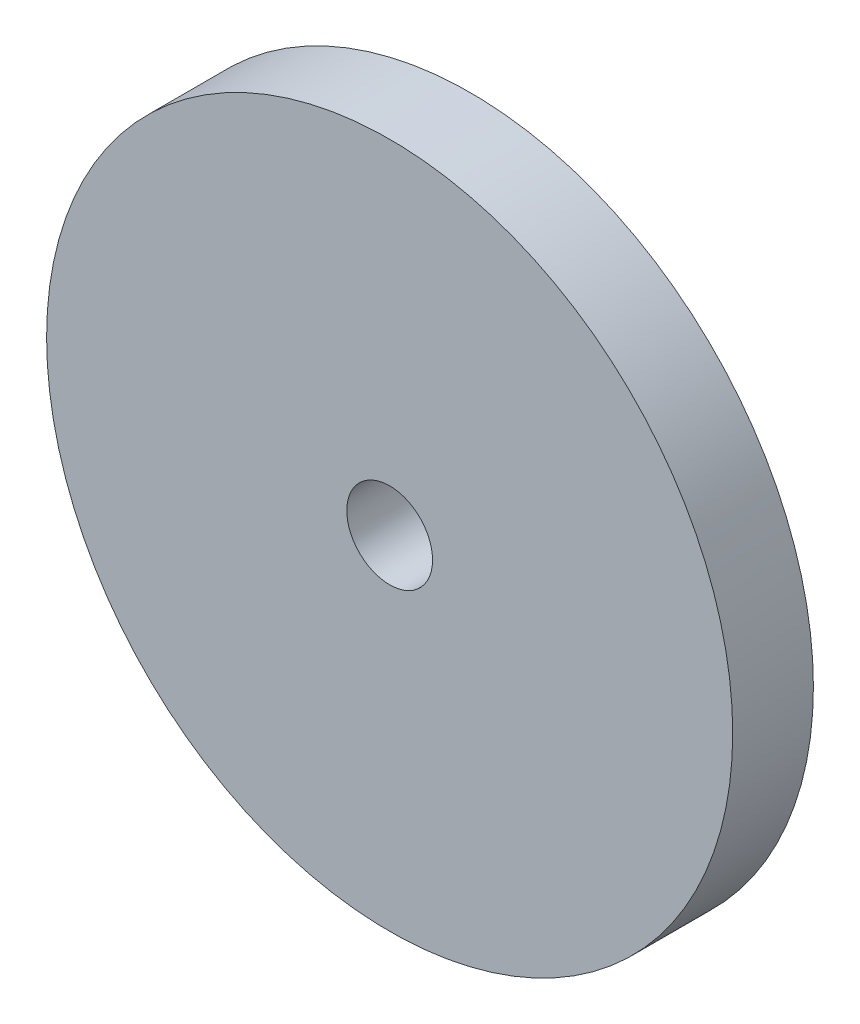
SolidWorks part; units mm, degrees
ref_plane "Front Plane" through (0, 0, 0) normal (0, 0, 1) x (1, 0, 0)
ref_plane "Top Plane" through (0, 0, 0) normal (0, 1, 0) x (1, 0, 0)
ref_plane "Right Plane" through (0, 0, 0) normal (1, 0, 0) x (0, 0, -1)
sketch "Sketch1" plane through (0, 0, 0) normal (0, 0, 1) x (1, 0, 0)
  circle A0 centre (0, 0) radius 13.5
  circle A1 centre (0, 0) radius 1.5875 construction
  circle A2 centre (0, 0) radius 1.6875
  dimension "D1" = 3.175
  dimension "D2" = 27
  dimension "D3" = 0.1
extrude "Boss-Extrude1" add sketch "Sketch1" along normal blind 3.175
other "Move Face1" [suppressed] parameters "D1"=0.0762
